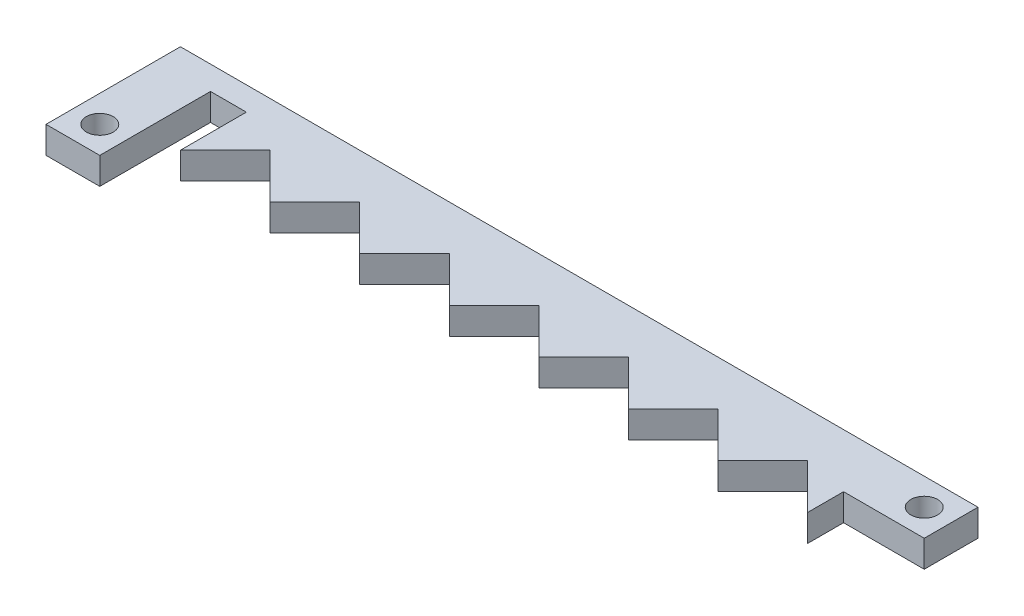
SolidWorks part; units mm, degrees
ref_plane "Front Plane" through (0, 0, 0) normal (0, 0, 1) x (1, 0, 0)
ref_plane "Top Plane" through (0, 0, 0) normal (0, 1, 0) x (1, 0, 0)
ref_plane "Right Plane" through (0, 0, 0) normal (1, 0, 0) x (0, 0, -1)
sketch "Sketch1" plane through (0, 0, 0) normal (0, 1, 0) x (1, 0, 0)
  line L0 (0, 42.3412) -> (0, 38.3412)
  line L1 (0, 38.3412) -> (5, 43.3412)
  line L2 (5, 43.3412) -> (10, 38.3412)
  line L3 (10, 38.3412) -> (15, 43.3412)
  line L4 (15, 43.3412) -> (20, 38.3412)
  line L5 (20, 38.3412) -> (25, 43.3412)
  line L6 (25, 43.3412) -> (30, 38.3412)
  line L7 (30, 38.3412) -> (35, 43.3412)
  line L8 (35, 43.3412) -> (40, 38.3412)
  line L9 (40, 38.3412) -> (45, 43.3412)
  line L10 (45, 43.3412) -> (50, 38.3412)
  line L11 (50, 38.3412) -> (55, 43.3412)
  line L12 (55, 43.3412) -> (60, 38.3412)
  line L13 (60, 38.3412) -> (65, 43.3412)
  line L14 (65, 43.3412) -> (70, 38.3412)
  line L15 (5, 48.3412) -> (70, 48.3412)
  line L16 (70, 42.3412) -> (70, 38.3412)
  line L20 (0, 42.3412) -> (0, 45.6968)
  line L26 (0, 48.3412) -> (-10, 48.3412)
  line L27 (5, 48.3412) -> (0, 48.3412)
  line L28 (-10, 48.3412) -> (-10, 33.3412)
  line L29 (-10, 33.3412) -> (-4, 33.3412)
  line L30 (-4, 33.3412) -> (-4, 45.6968)
  line L31 (-4, 45.6968) -> (0, 45.6968)
  line L32 (-10, 36.3412) -> (-4, 36.3412) construction
  line L33 (70, 48.3412) -> (79, 48.3412)
  line L34 (79, 48.3412) -> (79, 42.3412)
  line L35 (79, 42.3412) -> (70, 42.3412)
  line L36 (76, 48.3412) -> (76, 42.3412) construction
  circle A2 centre (-7, 36.3412) radius 1.5
  circle A3 centre (76, 45.3412) radius 1.5
  dimension "D7" = 3
  dimension "D9" = 6
  dimension "D11" = 3
  dimension "D1" = 10
  dimension "D2" = 5
  dimension "D3" = 6
  dimension "D5" = 15
  dimension "D6" = 10
  dimension "D8" = 3
  dimension "D10" = 9
  dimension "D12" = 3
  dimension "D4" = 7
extrude "Boss-Extrude1" add sketch "Sketch1" along normal blind 3
